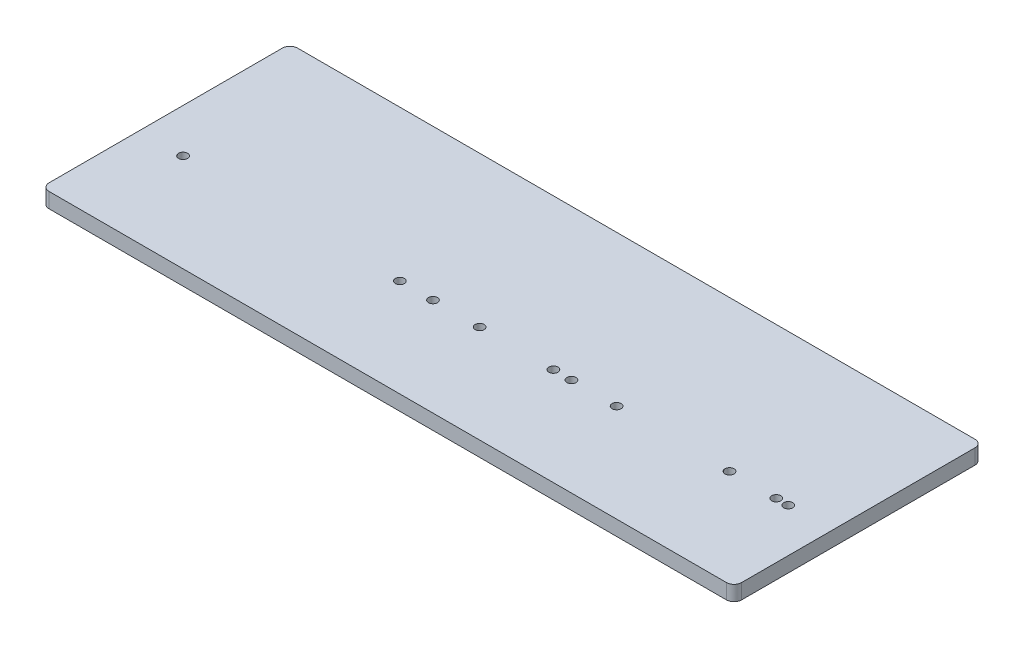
SolidWorks part; units mm, degrees
ref_plane "Plan de face" through (0, 0, 0) normal (0, 0, 1) x (1, 0, 0)
ref_plane "Plan de dessus" through (0, 0, 0) normal (0, 1, 0) x (1, 0, 0)
ref_plane "Plan de droite" through (0, 0, 0) normal (1, 0, 0) x (0, 0, -1)
sketch "Esquisse1" plane through (0, 0, 0) normal (0, 1, 0) x (1, 0, 0)
  line L1 (-58.8284, 121.8966) -> (401.1716, 121.8966)
  line L2 (-58.8284, 121.8966) -> (-58.8284, -43.1034)
  line L3 (-58.8284, -43.1034) -> (401.1716, -43.1034)
  line L4 (401.1716, 121.8966) -> (401.1716, -43.1034)
  dimension "D1" = 165
  dimension "D2" = 460
extrude "Extrusion1" add sketch "Esquisse1" along normal blind 10
sketch "Esquisse2" plane through (0, 10, 0) normal (0, 1, 0) x (-1, 0, 0)
  line L0 (58.8284, 43.1034) -> (-401.1716, 43.1034) construction
  line L1 (58.8284, -121.8966) -> (58.8284, 43.1034) construction
  circle A0 centre (29.8284, -21.8966) radius 3
  circle A1 centre (-136.1716, -21.8966) radius 3
  circle A2 centre (-114.1716, -21.8966) radius 3
  circle A3 centre (-167.1716, -21.8966) radius 3
  circle A4 centre (-216.1716, -21.8966) radius 3
  circle A5 centre (-228.1716, -21.8966) radius 3
  circle A6 centre (-258.1716, -21.8966) radius 3
  circle A7 centre (-333.1716, -21.8966) radius 3
  circle A8 centre (-364.1716, -21.8966) radius 3
  circle A9 centre (-372.1716, -21.8966) radius 3
  dimension "D1" = 65
  dimension "D3" = 402
  dimension "D4" = 6
  dimension "D6" = 6
  dimension "D8" = 6
  dimension "D10" = 6
  dimension "D12" = 6
  dimension "D14" = 6
  dimension "D16" = 6
  dimension "D18" = 6
  dimension "D20" = 6
  dimension "D2" = 29
  dimension "D5" = 394
  dimension "D7" = 363
  dimension "D9" = 288
  dimension "D11" = 258
  dimension "D13" = 246
  dimension "D15" = 197
  dimension "D17" = 166
  dimension "D19" = 144
extrude "Enlèv. mat.-Extru.1" cut sketch "Esquisse2" against normal through all
fillet "Congé1" radius 5 4 edges at (-58.8284, 5, -121.8966) (401.1716, 5, -121.8966) (401.1716, 5, 43.1034) (-58.8284, 5, 43.1034)
